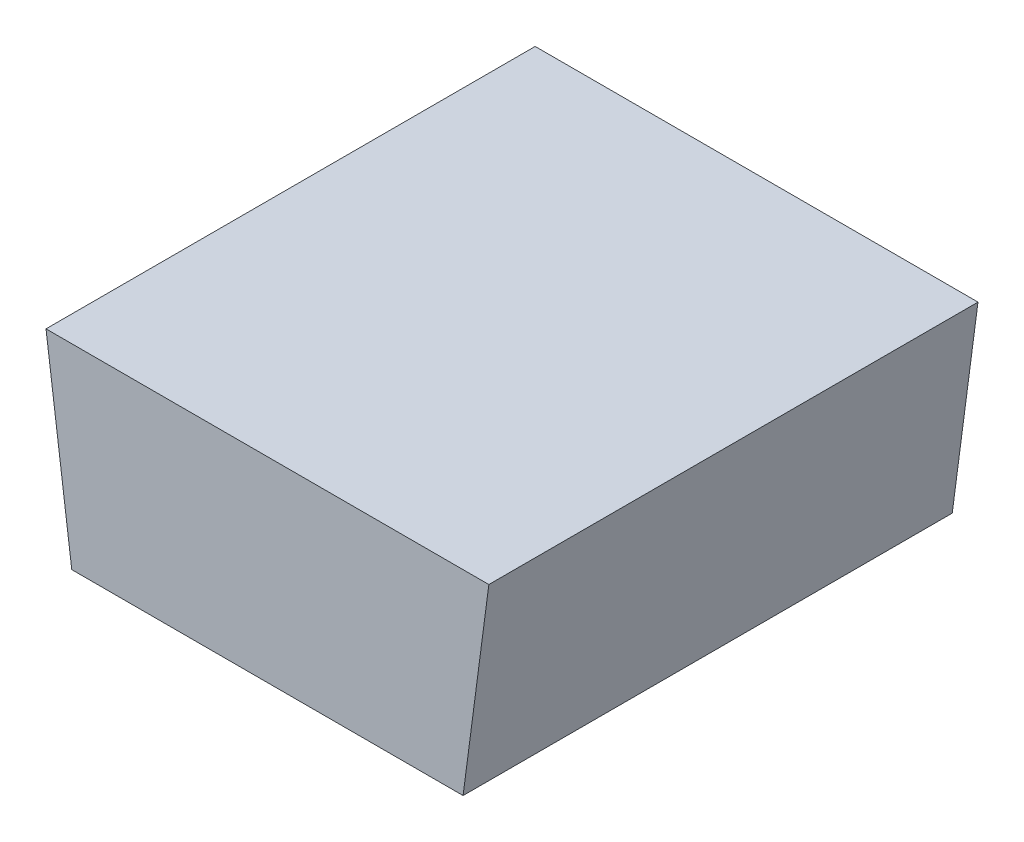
SolidWorks part; units mm, degrees
ref_plane "Plan de face" through (0, 0, 0) normal (0, 0, 1) x (1, 0, 0)
ref_plane "Plan de dessus" through (0, 0, 0) normal (0, 1, 0) x (1, 0, 0)
ref_plane "Plan de droite" through (0, 0, 0) normal (1, 0, 0) x (0, 0, -1)
sketch "Esquisse1" plane through (0, 0, 0) normal (0, 0, 1) x (1, 0, 0)
  line L0 (-20, 0) -> (20, 0)
  line L1 (20, 0) -> (22.633, 20)
  line L2 (22.633, 20) -> (-22.633, 20)
  line L3 (0, 0) -> (0, 24.8982) construction
  line L4 (-20, 0) -> (-22.633, 20)
  point P7 (0, 20)
  dimension "D1" = 20
  dimension "D2" = 97.5
  dimension "D3" = 20
extrude "Extrusion1" add sketch "Esquisse1" along normal blind 50
